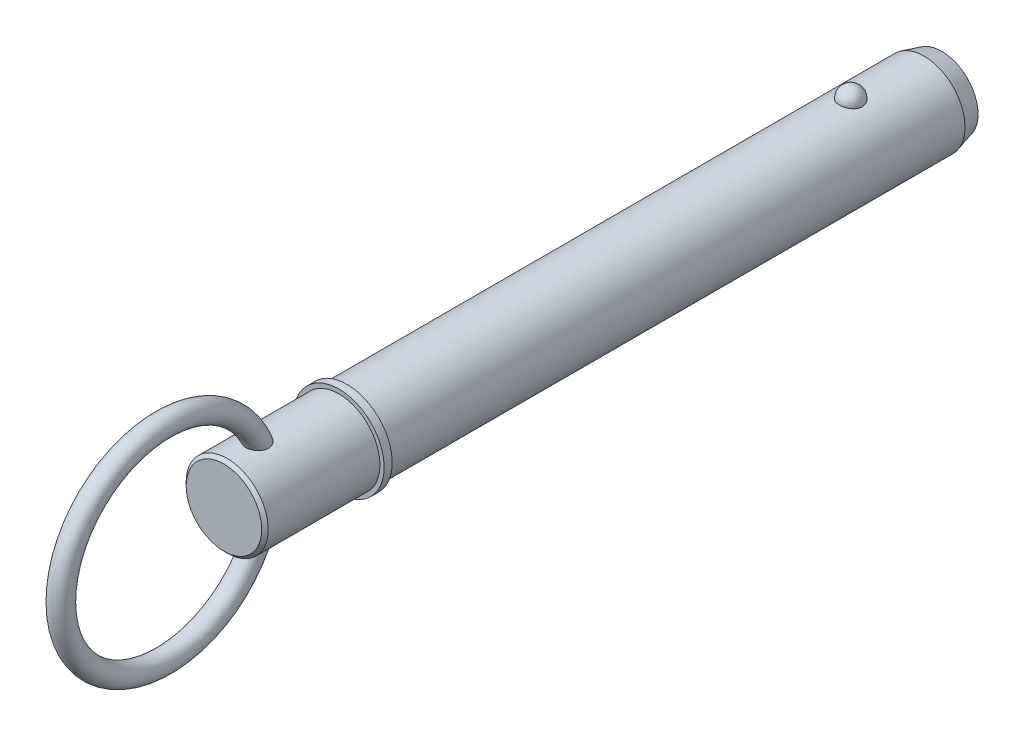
SolidWorks part; units mm, degrees
ref_plane "Front Plane" through (0, 0, 0) normal (0, 0, 1) x (1, 0, 0)
ref_plane "Top Plane" through (0, 0, 0) normal (0, 1, 0) x (1, 0, 0)
ref_plane "Right Plane" through (0, 0, 0) normal (1, 0, 0) x (0, 0, -1)
sketch "Sketch2" plane through (0, 0, 0) normal (0, 0, 1) x (1, 0, 0)
  circle A0 centre (0, 0) radius 12.7
  point P3 (0, 12.7)
  dimension "D1" = 25.4
extrude "Boss-Extrude1" add sketch "Sketch2" along normal blind 152.4
sketch "Sketch3" plane through (0, 0, 0) normal (0, 0, -1) x (-1, 0, 0)
  circle A0 centre (0, 0) radius 12.7
  dimension "D1" = 25.4
extrude "Boss-Extrude2" add sketch "Sketch3" along normal blind 31.75
chamfer "Chamfer1" distance 5.5 angle 15 1 edges at (-12.7, 0, -31.75)
sketch "Sketch18" plane through (0, 0, 0) normal (1, 0, 0) x (0, 0, -1)
  line L0 (26.25, 12.7) -> (-152.4, 12.7) construction
  line L1 (3.56, 16.26) -> (3.56, 9.14)
  line L2 (-152.4, -12.7) -> (26.25, -12.7) construction
  arc A0 (3.56, 16.26) -> (3.56, 9.14) centre (3.56, 12.7) ccw
  point P4 (0, 12.7)
  dimension "D1" = 28.96
revolve "Revolve1" add sketch "Sketch18" angle 360 about L1
sketch "Sketch19" plane through (0, 0, 0) normal (1, 0, 0) x (0, 0, -1)
  line L0 (-33.7288, 0) -> (-46.4542, 0) construction
sketch "Sketch20" plane through (0, 0, 0) normal (1, 0, 0) x (0, 0, -1)
  line L0 (-152.4, 0) -> (-152.4, 14)
  line L1 (-152.4, 12.7) -> (-152.4, -12.7) construction
  line L2 (-152.4, 14) -> (-154.9, 14)
  line L3 (-154.9, 14) -> (-154.9, 0)
  line L4 (-33.7288, 0) -> (-46.4542, 0) construction
  line L5 (-154.9, 0) -> (-152.4, 0)
  dimension "D1" = 14
  dimension "D2" = 2.5
revolve "Revolve2" add sketch "Sketch20" angle 360 about L0
sketch "Sketch21" plane through (0, 0, 152.4) normal (0, 0, -1) x (-1, 0, 0)
  circle A0 centre (0, 0) radius 12.7
  dimension "D1" = 25.4
extrude "Boss-Extrude3" add sketch "Sketch21" against normal blind 38.1
chamfer "Chamfer2" distance 1 angle 45 1 edges at (-12.7, 0, 190.5)
sketch "Sketch23" plane through (0, 0, 0) normal (1, 0, 0) x (0, 0, -1)
  line L0 (-190.5, 11.7) -> (-190.5, -11.7) construction
  circle A0 centre (-209.25, 0) radius 31.75
  point P2 (-177.5, 0)
  dimension "D1" = 63.5
  dimension "D2" = 13
sketch "Sketch24" plane through (0, 0, 0) normal (0, 1, 0) x (1, 0, 0)
  circle A0 centre (0, -177.5) radius 3.25
  dimension "D1" = 6.5
sweep "Sweep1" add profiles "Sketch24" path "Sketch23"
